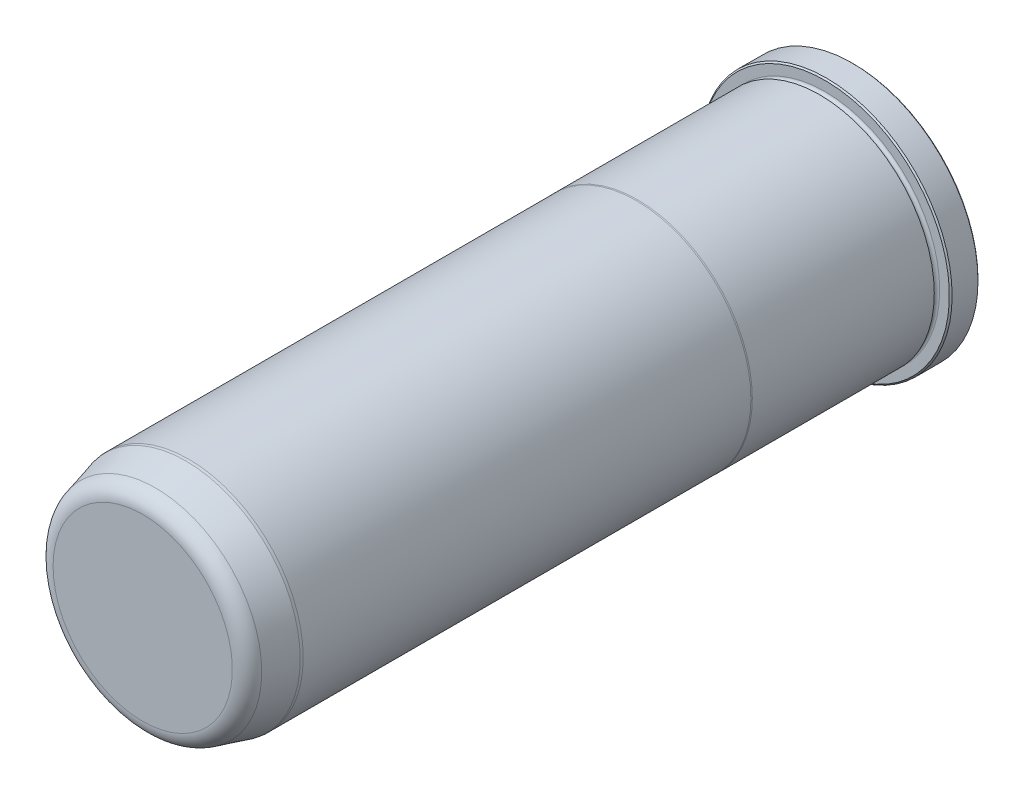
SolidWorks part; units mm, degrees
ref_plane "Front Plane" through (0, 0, 0) normal (0, 0, 1) x (1, 0, 0)
ref_plane "Top Plane" through (0, 0, 0) normal (0, 1, 0) x (1, 0, 0)
ref_plane "Right Plane" through (0, 0, 0) normal (1, 0, 0) x (0, 0, -1)
sketch "Sketch1" plane through (0, 0, 0) normal (1, 0, 0) x (0, 0, -1)
  line L0 (0, 0) -> (0, 34.798)
  line L1 (0, 34.798) -> (-7.9248, 34.798)
  line L2 (-7.9248, 34.798) -> (-7.9248, 31.7373)
  line L3 (-7.9248, 30.9753) -> (-9.4488, 30.9753) construction
  line L4 (-9.4488, 31.7373) -> (-9.4488, 31.7627)
  line L5 (-9.4488, 31.7627) -> (-59.8348, 31.7627)
  line L6 (-59.8348, 31.7627) -> (-60.198, 31.7373)
  line L7 (-60.198, 31.7373) -> (-184.15, 31.7373)
  line L9 (-196.85, 28.4719) -> (-196.85, 0)
  line L10 (-196.85, 0) -> (0, 0)
  line L11 (0, 0) -> (13.6287, 0) construction
  line L12 (-184.15, 31.7373) -> (-184.912, 31.6706)
  line L13 (-184.912, 31.6706) -> (-196.85, 28.4719)
  arc A0 (-9.4488, 31.7373) -> (-7.9248, 31.7373) centre (-8.6868, 31.7373) ccw
  dimension "D14" = 1.524
  dimension "D1" = 7.9248
  dimension "D2" = 1.524
  dimension "D3" = 69.596
  dimension "D4" = 63.5254
  dimension "D5" = 60.198
  dimension "D6" = 196.85
  dimension "D7" = 0.7874
  dimension "D8" = 4
  dimension "D9" = 63.4746
  dimension "D10" = 5
  dimension "D11" = 15
  dimension "D12" = 0.762
  dimension "D13" = 12.7
revolve "Revolve1" add sketch "Sketch1" angle 360 about L11
fillet "Fillet6" radius 4.7625 1 edges at (28.4719, 0, 196.85)
chamfer "Chamfer1" distance 0.381 angle 45 2 edges at (34.798, 0, 0) (34.798, 0, 7.9248)
